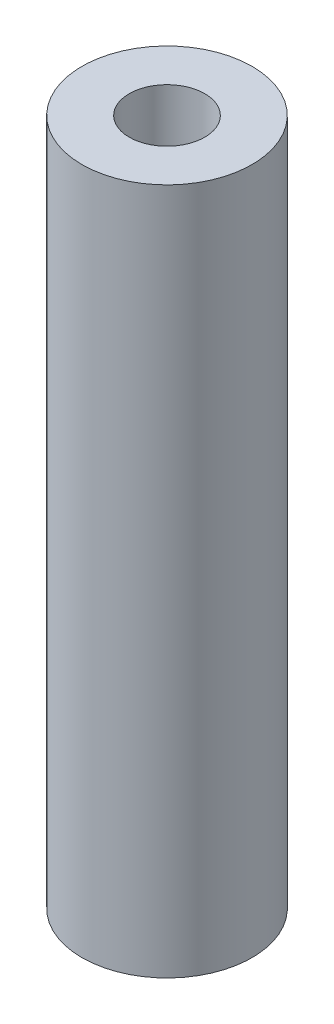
SolidWorks part; units mm, degrees
ref_plane "Front Plane" through (0, 0, 0) normal (0, 0, 1) x (1, 0, 0)
ref_plane "Top Plane" through (0, 0, 0) normal (0, 1, 0) x (1, 0, 0)
ref_plane "Right Plane" through (0, 0, 0) normal (1, 0, 0) x (0, 0, -1)
sketch "Sketch1" plane through (0, 0, 0) normal (0, 1, 0) x (1, 0, 0)
  circle A0 centre (0, 0) radius 1.375
  circle A1 centre (0, 0) radius 3.1
  dimension "D1" = 2.75
  dimension "D2" = 6.2
extrude "Boss-Extrude1" add sketch "Sketch1" along normal blind 25.025
